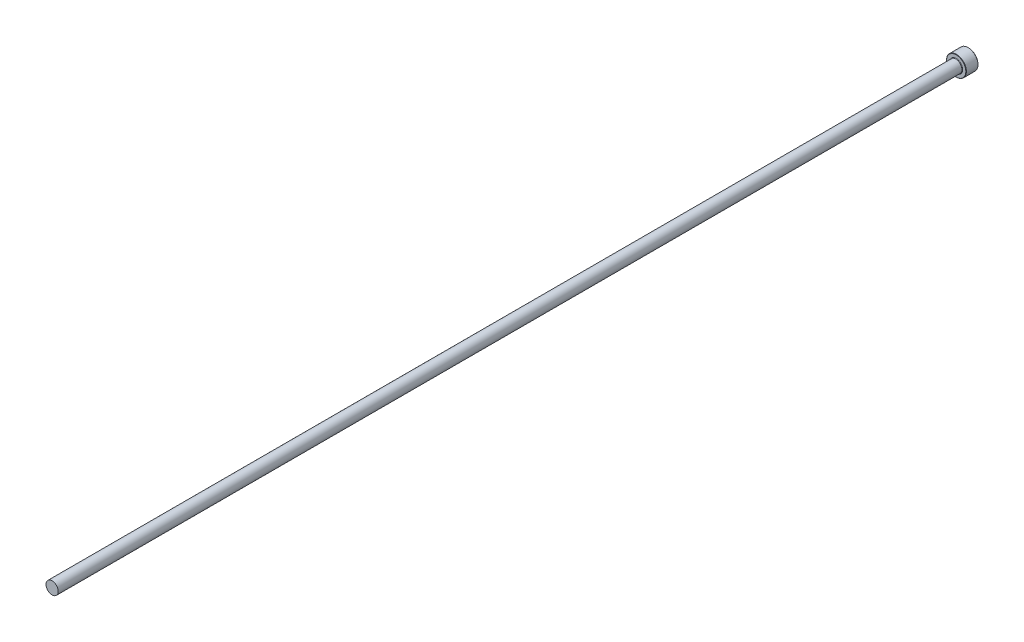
SolidWorks part; units mm, degrees
ref_plane "Front Plane" through (0, 0, 0) normal (0, 0, 1) x (1, 0, 0)
ref_plane "Top Plane" through (0, 0, 0) normal (0, 1, 0) x (1, 0, 0)
ref_plane "Right Plane" through (0, 0, 0) normal (1, 0, 0) x (0, 0, -1)
sketch "Sketch1" plane through (0, 0, 0) normal (1, 0, 0) x (0, 0, -1)
  line L0 (0, 0) -> (0, 6.5)
  line L1 (0, 7.15) -> (0, -7.15) construction
  line L2 (0, 6.5) -> (-8, 6.5)
  line L3 (-8, 6.5) -> (-8, 4.3)
  line L4 (-8.3, 4) -> (-600, 4)
  line L5 (-600, 4) -> (-600, 0)
  line L6 (7.15, 0) -> (-7.15, 0) construction
  line L7 (-600, 0) -> (0, 0)
  line L8 (-109.0506, 0) -> (16.9928, 0) construction
  arc A0 (-8, 4.3) -> (-8.3, 4) centre (-8.3, 4.3) cw
  dimension "D1" = 0.3
  dimension "D2" = 13
  dimension "D3" = 8
  dimension "D4" = 600
  dimension "D5" = 8
revolve "Revolve1" add sketch "Sketch1" angle 360 about L8
chamfer "Chamfer1" distance 0.2 angle 45 2 edges at (6.5, 0, 0) (6.5, 0, 8)
